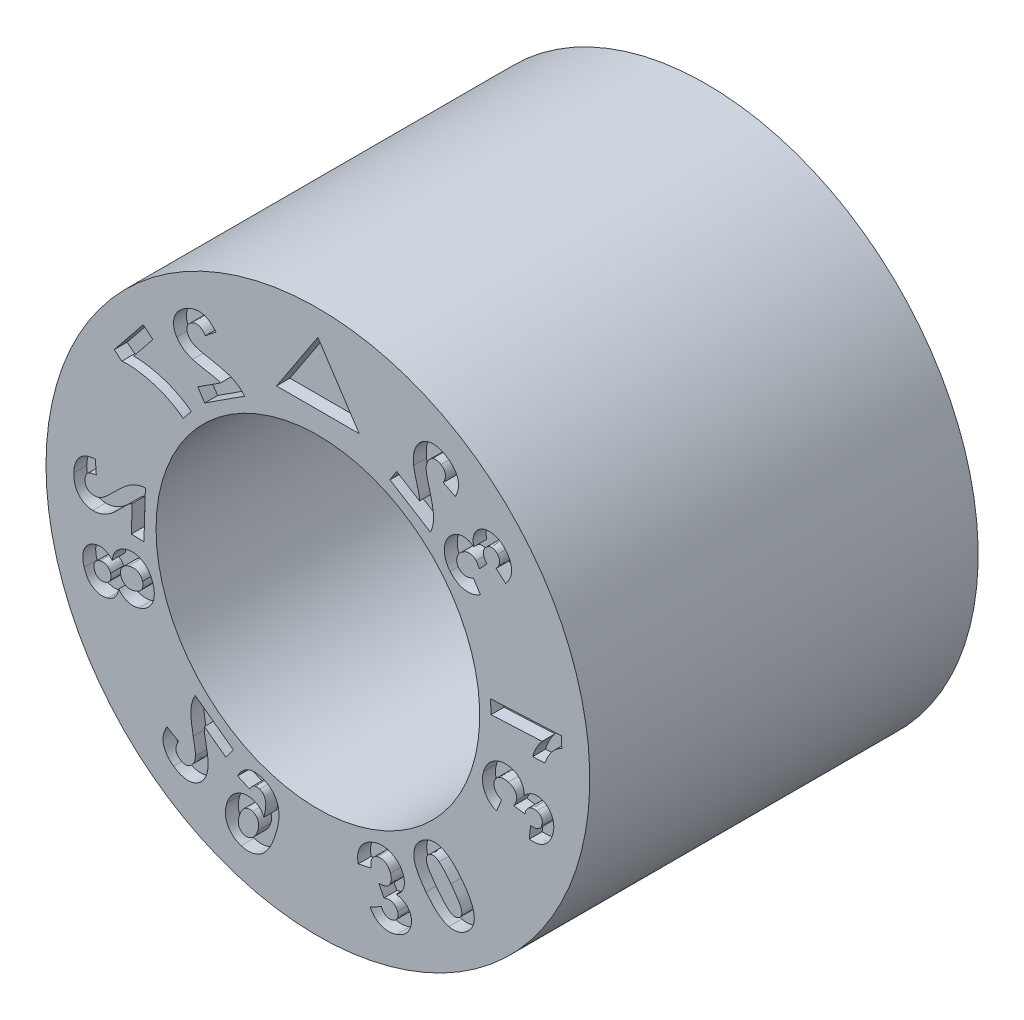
SolidWorks part; units mm, degrees
ref_plane "Front Plane" through (0, 0, 0) normal (0, 0, 1) x (1, 0, 0)
ref_plane "Top Plane" through (0, 0, 0) normal (0, 1, 0) x (1, 0, 0)
ref_plane "Right Plane" through (0, 0, 0) normal (1, 0, 0) x (0, 0, -1)
imported_body "Imported1"
other "DeleteFace1"
other "Move Face1" parameters "D1"=0.11
sketch "Sketch1" plane through (0, 0, 0) normal (0, 0, 1) x (1, 0, 0)
  line L0 (0, 0) -> (0, -2.7629) construction
  line L1 (0, 0) -> (-2.461, 1.4208) construction
  line L2 (0, 0) -> (2.4143, 1.3939) construction
  line L3 (0, 0) -> (2.7175, -1.569) construction
  line L4 (0, 0) -> (-2.7175, -1.569) construction
  line L5 (0, -1.65) -> (0, 1.65) construction
  arc A0 (-0.5502, 1.2383) -> (0.5768, 1.2261) centre (0, 0) ccw construction
  text T2 "27  28  29  30  31  32" font "Arial" height 0.55
  dimension "D1" = 2.71
  dimension "D2" = 60
  dimension "D3" = 60
extrude "Cut-Extrude1" cut sketch "Sketch1" against normal blind 0.1
